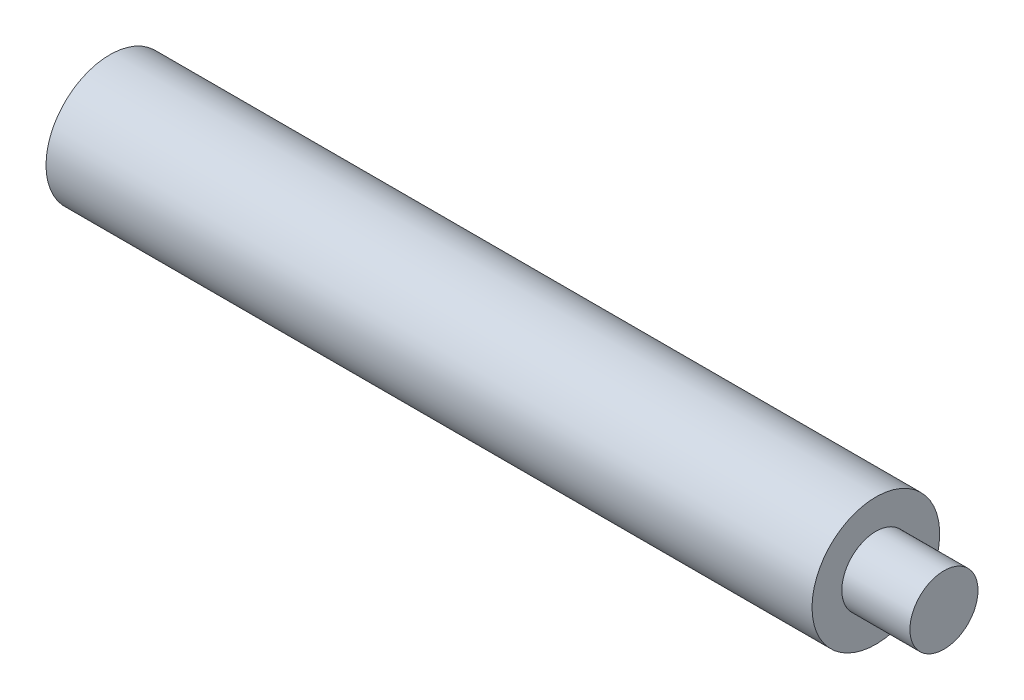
SolidWorks part; units mm, degrees
ref_plane "Plan de face" through (0, 0, 0) normal (0, 0, 1) x (1, 0, 0)
ref_plane "Plan de dessus" through (0, 0, 0) normal (0, 1, 0) x (1, 0, 0)
ref_plane "Plan de droite" through (0, 0, 0) normal (1, 0, 0) x (0, 0, -1)
sketch "Esquisse1" plane through (0, 0, 0) normal (1, 0, 0) x (0, 0, -1)
  circle A0 centre (0, 0) radius 4
  circle A1 centre (0, 0) radius 7.5
  dimension "D1" = 8
  dimension "D2" = 15
extrude "Extrusion1" add sketch "Esquisse1" along normal blind 90
sketch "Esquisse2" plane through (90, 0, 0) normal (1, 0, 0) x (0, 0, -1)
  circle A0 centre (0, 0) radius 4 construction
  circle A1 centre (0, 0) radius 4
extrude "Boss.-Extru.1" add sketch "Esquisse2" along normal blind 8 separate body
